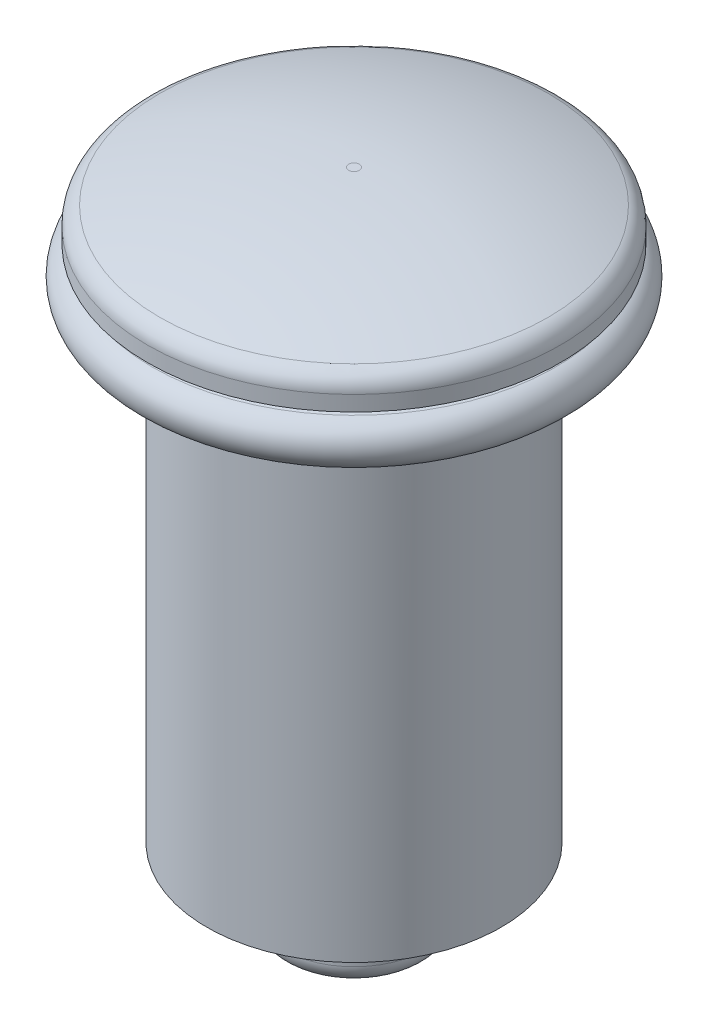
SolidWorks part; units mm, degrees
ref_plane "Front Plane" through (0, 0, 0) normal (0, 0, 1) x (1, 0, 0)
ref_plane "Top Plane" through (0, 0, 0) normal (0, 1, 0) x (1, 0, 0)
ref_plane "Right Plane" through (0, 0, 0) normal (1, 0, 0) x (0, 0, -1)
sketch "Sketch1" plane through (0, 0, 0) normal (1, 0, 0) x (0, 0, -1)
  line L0 (0, 0) -> (0, 79.8655) construction
  line L1 (1.9812, 0) -> (1.9812, -6.985)
  line L2 (1.9812, 0) -> (2.7813, 0)
  line L3 (2.7813, 0) -> (2.7813, 0.381)
  line L4 (0, 0.889) -> (0.0719, 0.889)
  line L8 (0, -6.985) -> (1.9812, -6.985)
  line L9 (0, 0.889) -> (0, -6.985)
  arc A0 (0.0719, 0.889) -> (2.7813, 0.381) centre (0.0719, -6.5901) cw
  point P13 (0, 0.889)
  dimension "D6" = 7.4791
  dimension "D1" = 3.9624
  dimension "D2" = 5.5626
  dimension "D3" = 0.889
  dimension "D4" = 0.381
  dimension "D5" = 6.985
revolve "Revolve1" add sketch "Sketch1" angle 360 about L0
fillet "Fillet1" radius 0.254 1 edges at (0, 0.381, -2.7813)
sketch "Sketch2" plane through (0, 0, 0) normal (1, 0, 0) x (0, 0, -1)
  line L0 (2.4615, 0) -> (2.7169, -0.0834)
  line L1 (-2.7813, 0) -> (2.7813, 0) construction
  line L2 (2.5892, -0.6894) -> (1.9812, -0.6894)
  line L3 (1.9812, -6.985) -> (1.9812, 0) construction
  line L4 (1.9812, -0.6894) -> (1.9812, 0)
  line L5 (1.9812, 0) -> (2.4615, 0)
  arc A0 (2.7169, -0.0834) -> (2.5892, -0.6894) centre (2.6203, -0.3795) cw
revolve "Revolve2" add sketch "Sketch2" angle 360
sketch "Sketch3" plane through (0, -6.985, 0) normal (0, -1, 0) x (1, 0, 0)
  circle A0 centre (0, 0) radius 0.9731
extrude "Boss-Extrude1" add sketch "Sketch3" along normal blind 1.016
fillet "Fillet2" radius 0.254 1 edges at (0, -8.001, -0.9731)
